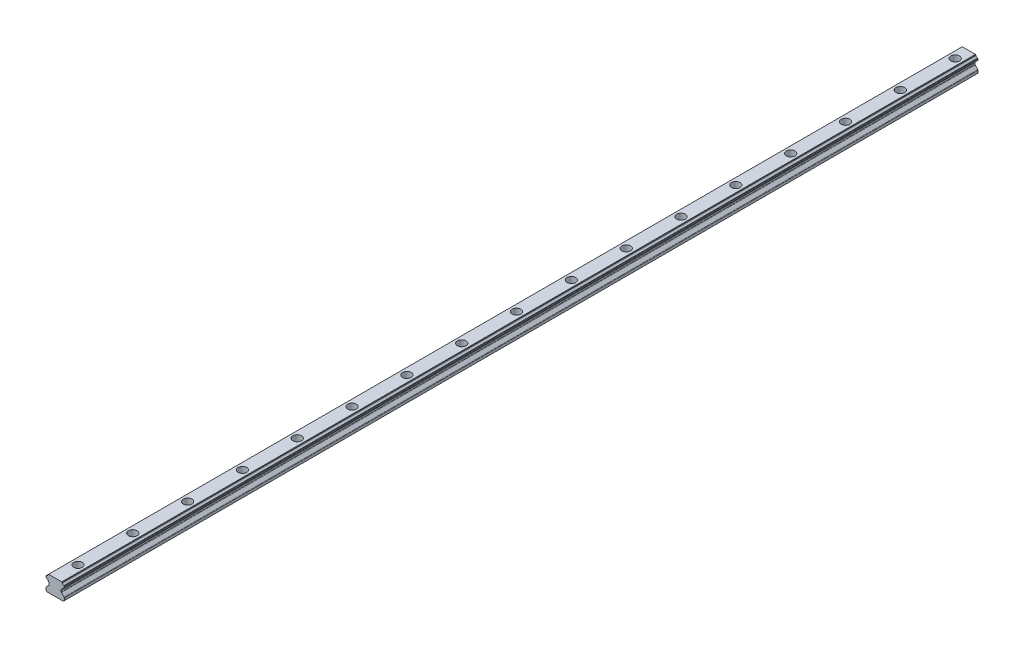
SolidWorks part; units mm, degrees
ref_plane "Front Plane" through (0, 0, 0) normal (0, 0, 1) x (1, 0, 0)
ref_plane "Top Plane" through (0, 0, 0) normal (0, 1, 0) x (1, 0, 0)
ref_plane "Right Plane" through (0, 0, 0) normal (1, 0, 0) x (0, 0, -1)
sketch "Sketch2" plane through (0, 0, 0) normal (0, 0, 1) x (1, 0, 0)
  line L0 (9.6753, 4.4012) -> (9.8536, 4.5794)
  line L1 (10, 4.9329) -> (10, 5.9901)
  line L2 (9.8536, 6.3437) -> (9.6633, 6.5339)
  line L3 (7.6477, 8.5496) -> (7.2307, 8.9665)
  line L4 (7.2307, 8.9665) -> (-7.2307, 8.9665)
  line L5 (-7.2307, 8.9665) -> (-7.6477, 8.5496)
  line L6 (-9.6633, 6.5339) -> (-9.8536, 6.3437)
  line L7 (-10, 5.9901) -> (-10, 4.9329)
  line L8 (-9.8536, 4.5794) -> (-9.6753, 4.4012)
  line L9 (-7.6454, 2.3712) -> (-6.8929, 1.6187)
  line L10 (-6.6, 0.9116) -> (-6.6, -0.6485)
  line L11 (-6.8929, -1.3556) -> (-9.7071, -4.1699)
  line L12 (-10, -4.877) -> (-10, -7.5335)
  line L13 (-10, -7.5335) -> (-9, -8.5335)
  line L14 (-9, -8.5335) -> (9, -8.5335)
  line L15 (9, -8.5335) -> (10, -7.5335)
  line L16 (10, -7.5335) -> (10, -4.877)
  line L17 (9.7071, -4.1699) -> (6.8929, -1.3556)
  line L18 (6.6, -0.6485) -> (6.6, 0.9116)
  line L19 (6.8929, 1.6187) -> (7.6454, 2.3712)
  arc A0 (9.8536, 4.5794) -> (10, 4.9329) centre (9.5, 4.9329) ccw
  arc A1 (10, 5.9901) -> (9.8536, 6.3437) centre (9.5, 5.9901) ccw
  arc A2 (9.6633, 6.5339) -> (9.4027, 6.6716) centre (9.3098, 6.1804) ccw
  arc A3 (7.7854, 8.289) -> (9.4027, 6.6716) centre (9.78, 8.6663) ccw
  arc A4 (7.7854, 8.289) -> (7.6477, 8.5496) centre (7.2941, 8.196) ccw
  arc A5 (-7.6477, 8.5496) -> (-7.7854, 8.289) centre (-7.2941, 8.196) ccw
  arc A6 (-9.4027, 6.6716) -> (-7.7854, 8.289) centre (-9.78, 8.6663) ccw
  arc A7 (-9.4027, 6.6716) -> (-9.6633, 6.5339) centre (-9.3098, 6.1804) ccw
  arc A8 (-9.8536, 6.3437) -> (-10, 5.9901) centre (-9.5, 5.9901) ccw
  arc A9 (-10, 4.9329) -> (-9.8536, 4.5794) centre (-9.5, 4.9329) ccw
  arc A10 (-9.6753, 4.4012) -> (-9.4124, 4.263) centre (-9.3218, 4.7547) ccw
  arc A11 (-7.7836, 2.6342) -> (-9.4124, 4.263) centre (-9.78, 2.2666) ccw
  arc A12 (-7.7836, 2.6342) -> (-7.6454, 2.3712) centre (-7.2919, 2.7248) ccw
  arc A13 (-6.6, 0.9116) -> (-6.8929, 1.6187) centre (-7.6, 0.9116) ccw
  arc A14 (-6.8929, -1.3556) -> (-6.6, -0.6485) centre (-7.6, -0.6485) ccw
  arc A15 (-9.7071, -4.1699) -> (-10, -4.877) centre (-9, -4.877) ccw
  arc A16 (10, -4.877) -> (9.7071, -4.1699) centre (9, -4.877) ccw
  arc A17 (6.6, -0.6485) -> (6.8929, -1.3556) centre (7.6, -0.6485) ccw
  arc A18 (6.8929, 1.6187) -> (6.6, 0.9116) centre (7.6, 0.9116) ccw
  arc A19 (7.6454, 2.3712) -> (7.7836, 2.6342) centre (7.2919, 2.7248) ccw
  arc A20 (9.4124, 4.263) -> (7.7836, 2.6342) centre (9.78, 2.2666) ccw
  arc A21 (9.4124, 4.263) -> (9.6753, 4.4012) centre (9.3218, 4.7547) ccw
extrude "Boss-Extrude1" add sketch "Sketch2" along normal blind 1000
sketch "Sketch3" plane through (0, 8.9665, 0) normal (0, 1, 0) x (1, 0, 0)
  line L0 (7.2307, 0) -> (-7.2307, 0) construction
  line L1 (10, -1000) -> (10, 0) construction
  point P0 (0, -15)
  dimension "D1" = 15
  dimension "D2" = 10
hole_wizard "CBORE for M16 Hex Head Bolt1" positions "Sketch3" profile "Sketch4" counterbore size "M16" standard "DIN"
sketch "Sketch4" plane through (0, 8.9665, 15) normal (1, 0, 0) x (0, 0, 1)
  line L0 (0, 0) -> (0, 17.5)
  line L1 (0, 17.5) -> (3, 17.5)
  line L3 (3, 17.5) -> (3, 8.5)
  line L4 (3, 8.5) -> (4.75, 8.5)
  line L5 (4.75, 8.5) -> (4.75, 0)
  line L7 (4.75, 0) -> (0, 0)
  line L11 (0, -6.35) -> (0, 107.95) construction
  dimension "Thru Hole Dia." = 6
  dimension "Thru Hole Depth" = 17.5
  dimension "C'Bore Dia." = 9.5
  dimension "C'Bore Depth" = 8.5
other "Fill Pattern1" parameters "D5"=0, "D6"=0, "D1"=60, "D2"=60, "D3"=0, "D9"=17, "D7"=17, "D8"=2
